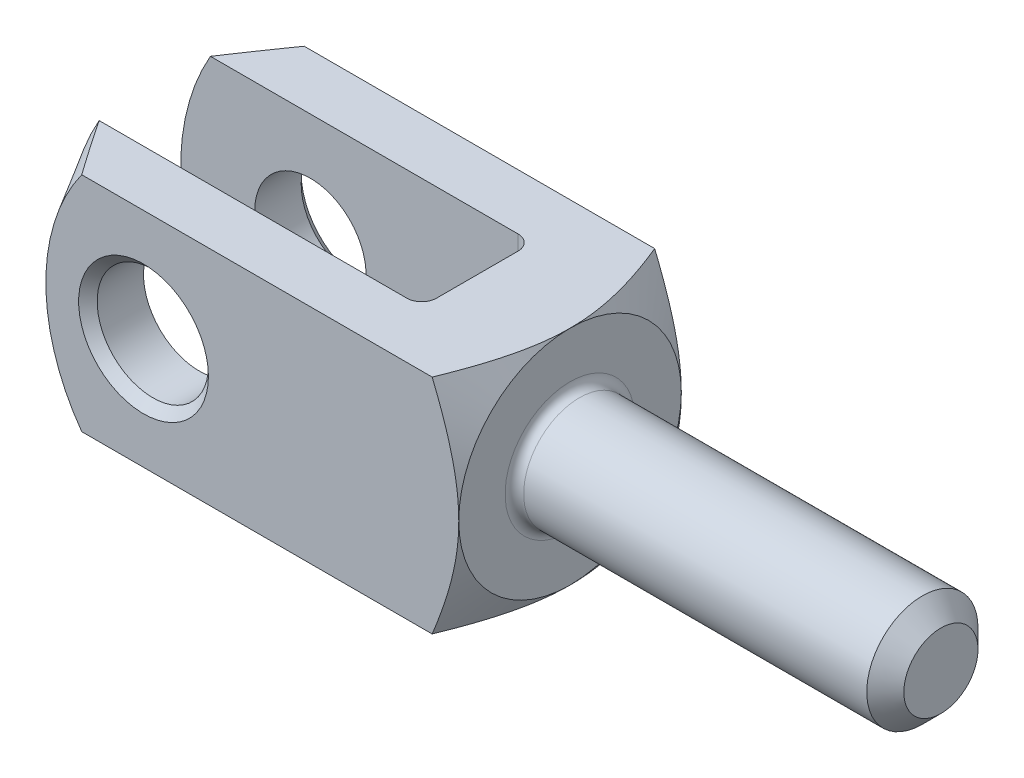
SolidWorks part; units mm, degrees
ref_plane "Front Plane" through (0, 0, 0) normal (0, 0, 1) x (1, 0, 0)
ref_plane "Top Plane" through (0, 0, 0) normal (0, 1, 0) x (1, 0, 0)
ref_plane "Right Plane" through (0, 0, 0) normal (1, 0, 0) x (0, 0, -1)
sketch "Sketch1" plane through (0, 0, 0) normal (1, 0, 0) x (0, 0, -1)
  line L0 (0, 0) -> (0, 50000) construction
  line L1 (0, 0) -> (50000, 0) construction
  line L2 (-6, -6) -> (-6, 6)
  line L3 (-6, 6) -> (6, 6)
  line L4 (6, -6) -> (6, 6)
  line L5 (-6, -6) -> (6, -6)
  point P9 (0, 6)
  point P11 (6, 0)
  point P12 (-6, 0)
  dimension "D1" = 12
  dimension "D2" = 12
extrude "Extrude1" add sketch "Sketch1" against normal blind 44
sketch "Sketch2" plane through (0, 0, 0) normal (1, 0, 0) x (0, 0, -1)
  circle A0 centre (0, 0) radius 3
  circle A1 centre (0, 0) radius 12
  dimension "D1" = 6
  dimension "D2" = 24
extrude "Extrude2" cut sketch "Sketch2" against normal blind 20
sketch "Sketch3" plane through (0, 0, 6) normal (0, 0, 1) x (1, 0, 0)
  circle A0 centre (-37, 0) radius 3
  dimension "D1" = 6
  dimension "D2" = 37
extrude "Extrude3" cut sketch "Sketch3" against normal through all
sketch "Sketch4" plane through (0, 6, 0) normal (0, 1, 0) x (1, 0, 0)
  line L0 (0, 0) -> (-50000, 0) construction
  line L1 (-44, -3) -> (-44, 3)
  line L2 (-44, 6) -> (-44, -6) construction
  line L3 (-44, 3) -> (-25, 3)
  line L4 (-25, 3) -> (-25, -3)
  line L5 (-37, 6) -> (-37, -6) construction
  line L6 (-44, -3) -> (-25, -3)
  point P7 (-37, 0)
  point P13 (-25, 0)
  point P14 (-44, 0)
  dimension "D1" = 12
  dimension "D2" = 6
extrude "Extrude4" cut sketch "Sketch4" against normal through all
fillet "Fillet1" radius 0.8 2 edges at (-25, 0, 3) (-25, 0, -3)
fillet "Fillet2" radius 0.5 1 edges at (-20, 0, -3)
chamfer "Chamfer2" distance 0.5 angle 45 2 edges at (-34, 0, -6) (-34, 0, 6)
sketch "Sketch6" plane through (0, 0, 0) normal (0, 0, 1) x (1, 0, 0)
  line L0 (-20, -6) -> (-20, -12)
  line L1 (-20, -12) -> (-23.4641, -12)
  line L2 (-23.4641, -12) -> (-20, -6)
  dimension "D1" = 30
  dimension "D2" = 12
revolve "Cut-Revolve1" cut sketch "Sketch6" angle 360 about axis through (-20, 0, 0) along (1, 0, 0)
sketch "Sketch7" plane through (0, 0, 0) normal (0, 1, 0) x (1, 0, 0)
  line L0 (-42.2679, -6) -> (-44, -3)
  line L1 (-44, 3) -> (-42.2679, 6)
  line L2 (-42.2679, 6) -> (-56, 6)
  line L3 (-44, 3) -> (-44, -3)
  line L4 (-56, 6) -> (-56, -6)
  line L5 (-56, -6) -> (-42.2679, -6)
  line L6 (-44, 6) -> (-21.4349, 6) construction
  line L7 (-44, -6) -> (-21.4349, -6) construction
  line L8 (-32, 0.6162) -> (-32, 50000.6162) construction
  dimension "D1" = 120
  dimension "D2" = 12
  dimension "D3" = 12
revolve "Cut-Revolve2" cut sketch "Sketch7" angle 180 about L8
chamfer "Chamfer3" distance 1 angle 45 1 edges at (0, 0, -3)
equation "\"D2@Sketch1\" = \"D1@Sketch1\""
equation "\"D2@Sketch2\" = \"D1@Sketch1\"/.5"
equation "\"D2@Sketch6\" = \"D1@Sketch1\""
equation "\"D2@Sketch7\" = \"D1@Sketch1\""
equation "\"D3@Sketch7\" = \"D1@Sketch1\""
